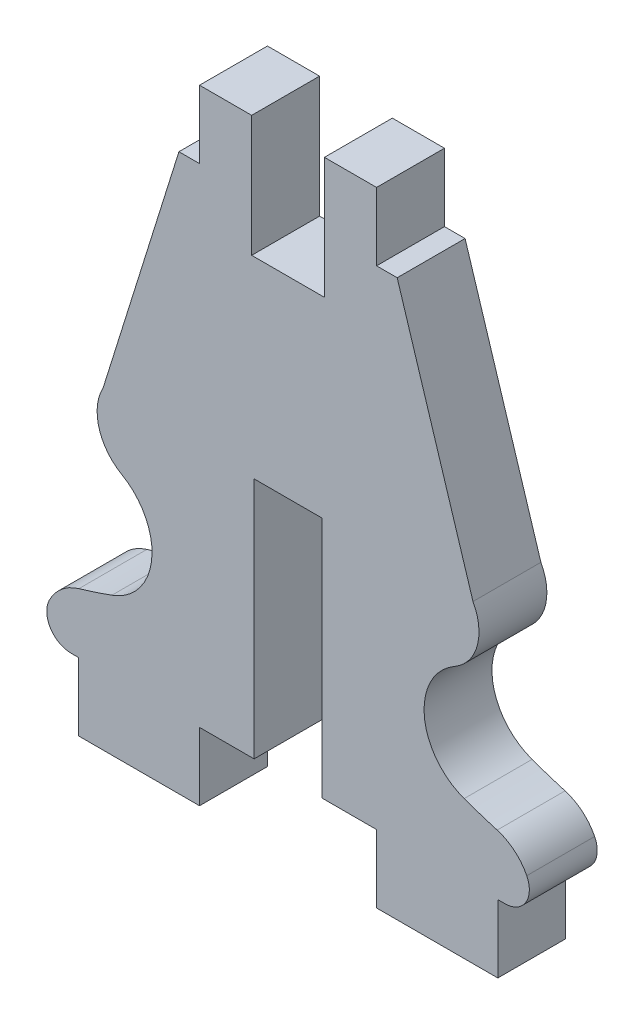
SolidWorks part; units mm, degrees
ref_plane "Front Plane" through (0, 0, 0) normal (0, 0, 1) x (1, 0, 0)
ref_plane "Top Plane" through (0, 0, 0) normal (0, 1, 0) x (1, 0, 0)
ref_plane "Right Plane" through (0, 0, 0) normal (1, 0, 0) x (0, 0, -1)
sketch "Sketch1" plane through (0, 0, 0) normal (0, 0, 1) x (1, 0, 0)
  line L0 (0, -4.0518) -> (0, 50.9162) construction
  line L11 (-8.65, 0) -> (-8.95, 0)
  line L13 (-1.4, 10) -> (-1.4, 0)
  line L14 (-8.65, -2.8) -> (-8.65, 0)
  line L16 (-1.4, 0) -> (-3.65, 0)
  line L17 (-7.6265, 10.1319) -> (-4.5, 20.1319)
  line L19 (-1.4, 10) -> (1.4, 10)
  line L20 (7.6265, 10.1319) -> (4.5, 20.1319)
  line L21 (1.4, 0) -> (3.65, 0)
  line L23 (8.65, -2.8) -> (8.65, 0)
  line L24 (1.4, 10) -> (1.4, 0)
  line L26 (8.65, 0) -> (8.95, 0)
  line L31 (-21.5642, 0) -> (20.7966, 0) construction
  line L32 (-4.5, 20.1319) -> (-3.65, 20.1319)
  line L33 (-3.65, 20.1319) -> (-3.65, 22.9319)
  line L34 (-3.65, 22.9319) -> (-1.5, 22.9319)
  line L35 (3.65, 22.9319) -> (3.65, 20.1319)
  line L36 (3.65, 20.1319) -> (4.5, 20.1319)
  line L37 (-3.65, 0) -> (-3.65, -2.8)
  line L39 (3.65, 0) -> (3.65, -2.8)
  line L41 (-3.65, -2.8) -> (-8.65, -2.8)
  line L42 (3.65, -2.8) -> (8.65, -2.8)
  line L43 (1.5, 22.9319) -> (3.65, 22.9319)
  line L45 (-1.5, 22.9319) -> (-1.5, 17.9319)
  line L47 (1.5, 22.9319) -> (1.5, 17.9319)
  line L53 (-1.5, 17.9319) -> (1.5, 17.9319)
  arc A6 (-7.2625, 2.9132) -> (-6.8664, 7.4352) centre (-8.1086, 5.2657) ccw
  arc A7 (-8.6226, 2.4685) -> (-7.2625, 2.9132) centre (-15.5391, 25.924) ccw
  arc A8 (-9.8431, 1.4498) -> (-8.6226, 2.4685) centre (-8.0569, 0.5502) cw
  arc A9 (-8.95, 0) -> (-9.8431, 1.4498) centre (-8.95, 1) cw
  arc A10 (-6.8664, 7.4352) -> (-7.6265, 10.1319) centre (-5.8726, 9.1708) cw
  arc A11 (6.8664, 7.4352) -> (7.6265, 10.1319) centre (5.8726, 9.1708) ccw
  arc A12 (8.95, 0) -> (9.8431, 1.4498) centre (8.95, 1) ccw
  arc A13 (9.8431, 1.4498) -> (8.6226, 2.4685) centre (8.0569, 0.5502) ccw
  arc A14 (8.6226, 2.4685) -> (7.2625, 2.9132) centre (15.5391, 25.924) cw
  arc A15 (7.2625, 2.9132) -> (6.8664, 7.4352) centre (8.1086, 5.2657) cw
  point P15 (0, 10)
  point P24 (0, 8.8968)
  point P40 (0, 10)
extrude "Boss-Extrude1" add sketch "Sketch1" along normal blind 2.8
equation "\"mdf\" = 3mm - \"kerf\"'chess table material"
equation "\"diameter\"= ( 25mm - 5mm )'diameter of all of the pieces in relation with the chess table"
equation "\"size press fit\"= 5mm"
equation "\"gap\" = ( ( \"diameter\" - ( \"size press fit\" * 3 ) ) / 4mm ) + \"kerf\""
equation "\"gap press fit\" = ( \"diameter\" - \"size press fit\" - \"size press fit\" - \"gap\" - \"gap\" ) + \"kerf\""
equation "\"D13@Sketch1\"=\"gap press fit\""
equation "\"D15@Sketch1\"=\"mdf\""
equation "\"D1@Boss-Extrude1\"=\"mdf\""
equation "\"gap y\"= \"gap\" + 1mm"
equation "\"kerf\"= 0.2"
equation "\"D3@Sketch1\"=\"size press fit\""
